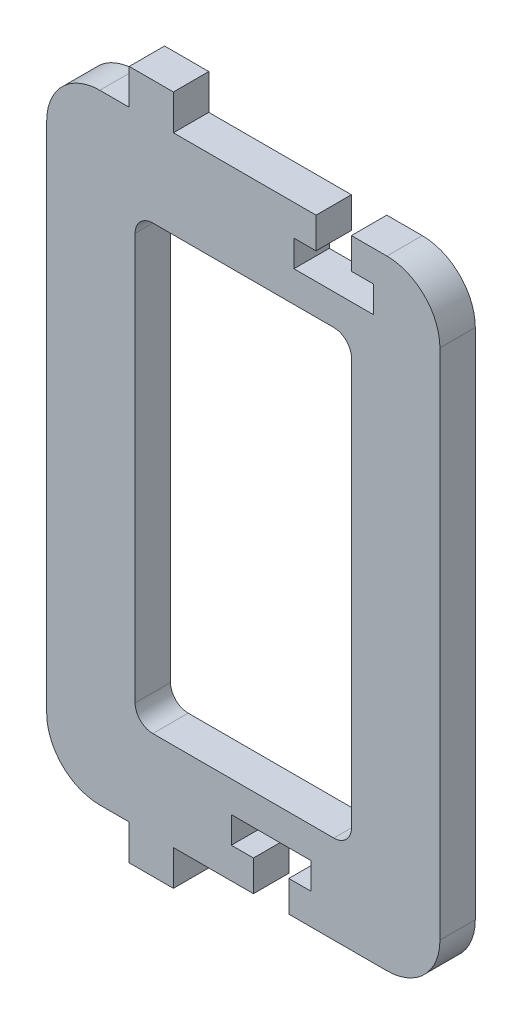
SolidWorks part; units mm, degrees
ref_plane "Alzado" through (0, 0, 0) normal (0, 0, 1) x (1, 0, 0)
ref_plane "Planta" through (0, 0, 0) normal (0, 1, 0) x (1, 0, 0)
ref_plane "Vista lateral" through (0, 0, 0) normal (1, 0, 0) x (0, 0, -1)
sketch "Croquis1" plane through (0, 0, 0) normal (0, 0, 1) x (1, 0, 0)
  line L0 (-48.3652, -20.8541) -> (-51.6952, -20.8541)
  line L1 (-48.3652, -20.8541) -> (-48.3652, -24.8541)
  line L2 (-48.3652, -24.8541) -> (-43.3652, -24.8541)
  line L3 (-43.3652, -24.8541) -> (-43.3652, -20.8541)
  line L4 (-43.3652, -20.8541) -> (-34.3152, -20.8541)
  line L5 (-34.3152, -20.8541) -> (-34.3152, -17.3541)
  line L6 (-34.3152, -17.3541) -> (-36.8152, -17.3541)
  line L7 (-36.8152, -17.3541) -> (-36.8152, -14.3541)
  line L8 (-27.8152, -14.3541) -> (-36.8152, -14.3541)
  line L9 (-27.8152, -14.3541) -> (-27.8152, -17.3541)
  line L10 (-27.8152, -17.3541) -> (-30.3152, -17.3541)
  line L11 (-30.3152, -17.3541) -> (-30.3152, -20.8541)
  line L12 (-20.7352, 42.6459) -> (-29.7352, 42.6459)
  line L13 (-30.3152, -20.8541) -> (-19.2252, -20.8541)
  line L14 (-13.2252, -14.8541) -> (-13.2252, 43.1459)
  line L15 (-57.6952, -14.8541) -> (-57.6952, 43.1459)
  line L16 (-48.3652, 49.1459) -> (-48.3652, 53.1459)
  line L17 (-48.3652, 53.1459) -> (-43.3652, 53.1459)
  line L18 (-43.3652, 53.1459) -> (-43.3652, 49.1459)
  line L19 (-43.3652, 49.1459) -> (-27.2352, 49.1459)
  line L20 (-27.2352, 49.1459) -> (-27.2352, 45.6459)
  line L21 (-27.2352, 45.6459) -> (-29.7352, 45.6459)
  line L22 (-29.7352, 45.6459) -> (-29.7352, 42.6459)
  line L24 (-20.7352, 42.6459) -> (-20.7352, 45.6459)
  line L25 (-20.7352, 45.6459) -> (-23.2352, 45.6459)
  line L26 (-23.2352, 45.6459) -> (-23.2352, 49.1459)
  line L27 (-23.2352, 49.1459) -> (-19.2252, 49.1459)
  line L28 (-51.6952, 49.1459) -> (-48.3652, 49.1459)
  line L33 (-47.6952, 14.1459) -> (-47.6952, -8.8541)
  line L34 (-45.6952, -10.8541) -> (-25.2252, -10.8541)
  line L35 (-23.2252, -8.8541) -> (-23.2252, 37.1459)
  line L36 (-25.2252, 39.1459) -> (-45.6952, 39.1459)
  line L37 (-47.6952, 37.1459) -> (-47.6952, 14.1459)
  arc A0 (-51.6952, -20.8541) -> (-57.6952, -14.8541) centre (-51.6952, -14.8541) cw
  arc A1 (-19.2252, -20.8541) -> (-13.2252, -14.8541) centre (-19.2252, -14.8541) ccw
  arc A2 (-13.2252, 43.1459) -> (-19.2252, 49.1459) centre (-19.2252, 43.1459) ccw
  arc A3 (-57.6952, 43.1459) -> (-51.6952, 49.1459) centre (-51.6952, 43.1459) cw
  arc A4 (-25.2252, -10.8541) -> (-23.2252, -8.8541) centre (-25.2252, -8.8541) ccw
  arc A5 (-23.2252, 37.1459) -> (-25.2252, 39.1459) centre (-25.2252, 37.1459) ccw
  arc A6 (-45.6952, 39.1459) -> (-47.6952, 37.1459) centre (-45.6952, 37.1459) ccw
  arc A7 (-47.6952, -8.8541) -> (-45.6952, -10.8541) centre (-45.6952, -8.8541) ccw
  point P47 (-8.5252, 49.1459)
  dimension "D1" = 6
  dimension "D2" = 2
extrude "Saliente-Extruir1" add sketch "Croquis1" along normal blind 4
